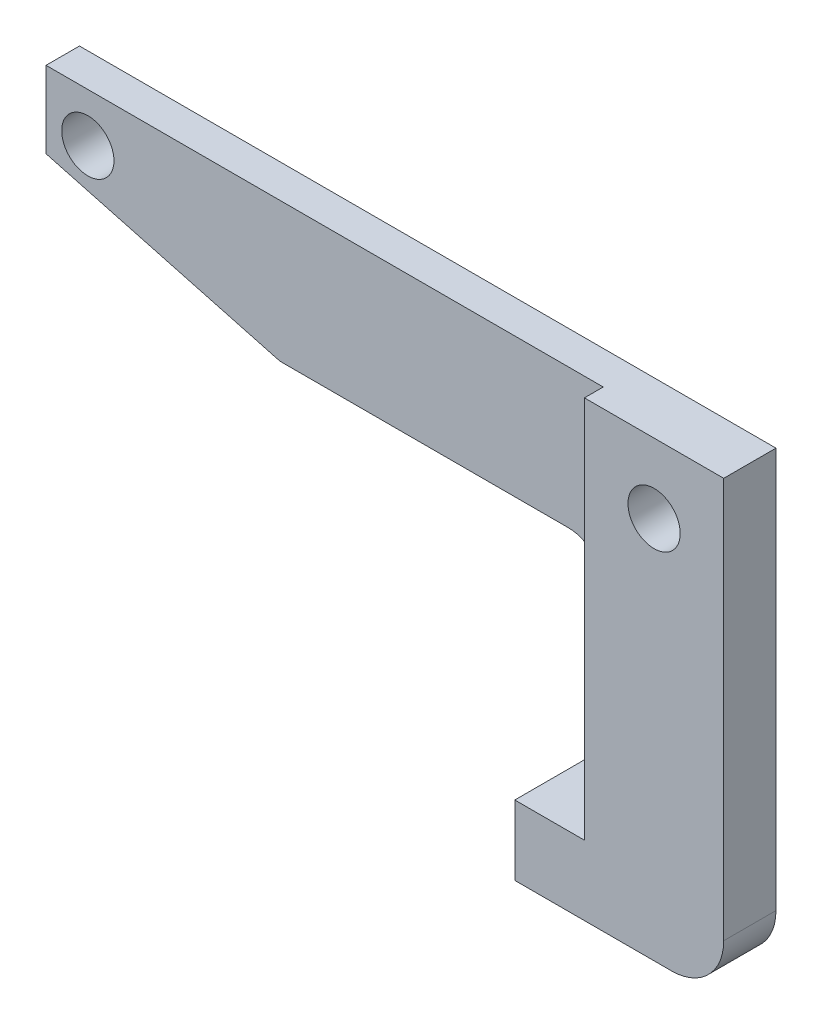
SolidWorks part; units mm, degrees
ref_plane "Plane1" through (0, 0, 0) normal (0, 0, 1) x (1, 0, 0)
ref_plane "Plane2" through (0, 0, 0) normal (0, 1, 0) x (1, 0, 0)
ref_plane "Plane3" through (0, 0, 0) normal (1, 0, 0) x (0, 0, -1)
sketch "Sketch1" plane through (0, 0, 0) normal (0, 0, 1) x (1, 0, 0)
  line L0 (-114.3, 12.7) -> (-114.3, -12.7)
  line L1 (-114.3, -12.7) -> (-12.7, -12.7)
  line L2 (12.7, 12.7) -> (-114.3, 12.7)
  line L3 (12.7, 12.7) -> (12.7, -69.85)
  line L4 (-12.7, -12.7) -> (-12.7, -57.15)
  line L5 (12.7, -69.85) -> (-25.4, -69.85)
  line L6 (-25.4, -69.85) -> (-25.4, -57.15)
  line L7 (-25.4, -57.15) -> (-12.7, -57.15)
  dimension "D1" = 82.55
  dimension "D2" = 127
  dimension "D3" = 44.45
  dimension "D4" = 25.4
  dimension "D5" = 12.7
  dimension "D6" = 12.7
  dimension "D7" = 25.4
  dimension "D8" = 38.1
extrude "Base-Extrude" add sketch "Sketch1" along normal blind 12.7
sketch "Sketch2" plane through (0, 0, 12.7) normal (0, 0, 1) x (1, 0, 0)
  circle A0 centre (0, 0) radius 4.7625
  dimension "D1" = 9.525
extrude "Cut-Extrude1" cut sketch "Sketch2" against normal through all
sketch "Sketch3" plane through (-40.8261, 4.3037, 12.7) normal (0, 0, 1) x (1, 0, 0)
  line L0 (-73.4739, 8.3963) -> (-73.4739, -17.0037) construction
  line L1 (53.5261, 8.3963) -> (-73.4739, 8.3963) construction
  circle A0 centre (-65.8539, -0.4937) radius 4.7625
  dimension "D1" = 9.525
  dimension "D2" = 7.62
  dimension "D3" = 8.89
extrude "Cut-Extrude2" cut sketch "Sketch3" against normal through all
chamfer "Chamfer1" distance 11.43 angle 75 1 edges at (-114.3, -12.7, 6.35)
sketch "Sketch5" plane through (-65.558, -0.2007, 12.7) normal (0, 0, 1) x (1, 0, 0)
  line L0 (52.858, 12.9007) -> (-48.742, 12.9007)
  line L1 (52.858, 12.9007) -> (52.858, -12.4993)
  line L2 (-48.742, -12.4993) -> (52.858, -12.4993)
  line L3 (-48.742, -12.4993) -> (-48.742, 12.9007)
  line L4 (-48.742, 12.9007) -> (-48.742, -1.0693) construction
  line L5 (78.258, 12.9007) -> (-48.742, 12.9007) construction
  line L6 (52.858, -12.4993) -> (52.858, -56.9493) construction
  line L7 (-6.0847, -12.4993) -> (52.858, -12.4993) construction
extrude "Cut-Extrude4" cut sketch "Sketch5" against normal blind 3.429
fillet "Fillet2" radius 9.525 1 edges at (12.7, -69.85, 6.35)
chamfer "Chamfer2" distance 3.175 angle 45 3 edges at (-11.1125, -69.85, 0) (9.9102, -67.0602, 0) (12.7, -23.8125, 0)
chamfer "Chamfer3" distance 3.175 angle 45 2 edges at (-52.3875, 12.7, 0) (11.1125, 12.7, 1.5875)
fillet "Fillet3" radius 6.35 1 edges at (-12.7, -12.7, 4.6355)
sketch "Sketch8" plane through (0, 0, 0) normal (0, 0, -1) x (-1, 0, 0)
  circle A0 centre (0, 0) radius 9.525
  dimension "D1" = 19.05
extrude "Cut-Extrude5" cut sketch "Sketch8" against normal blind 4.7752
